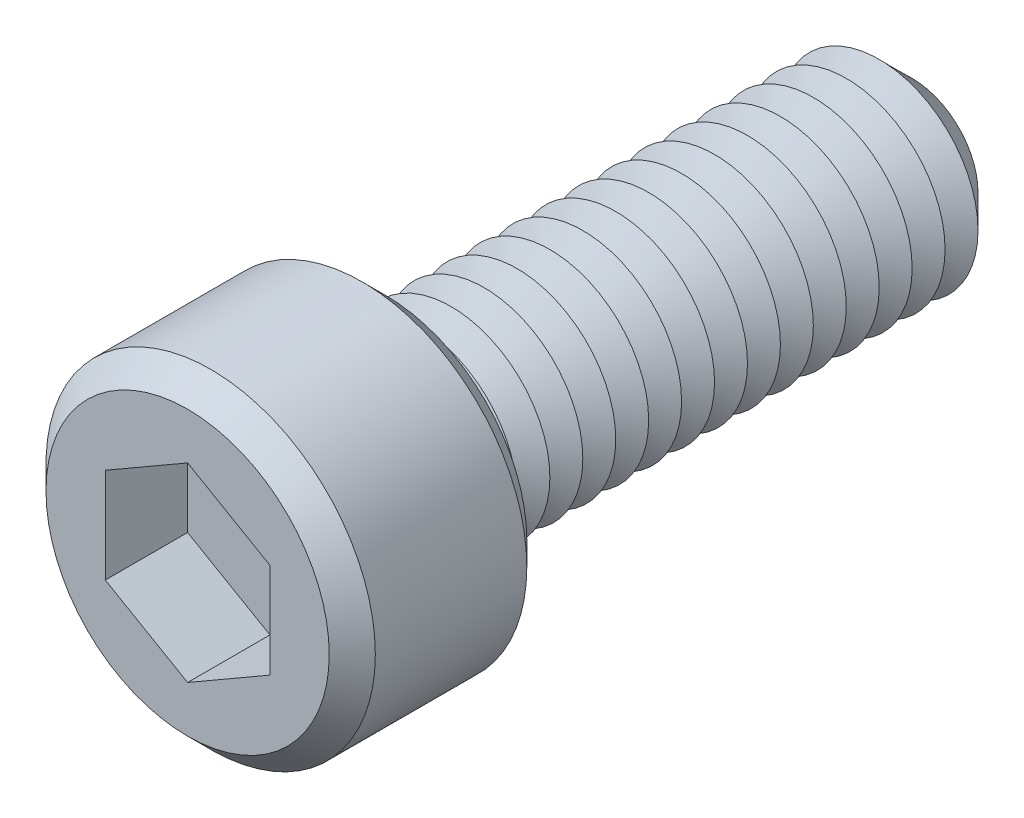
SolidWorks part; units mm, degrees
ref_plane "Front Plane" through (0, 0, 0) normal (0, 0, 1) x (1, 0, 0)
ref_plane "Top Plane" through (0, 0, 0) normal (0, 1, 0) x (1, 0, 0)
ref_plane "Right Plane" through (0, 0, 0) normal (1, 0, 0) x (0, 0, -1)
sketch "Sketch1" plane through (0, 0, 0) normal (0, 0, 1) x (1, 0, 0)
  circle A0 centre (0, 0) radius 5
  dimension "D1" = 10
extrude "Boss-Extrude1" add sketch "Sketch1" along normal blind 6
sketch "Sketch2" plane through (0, 0, 0) normal (0, 0, -1) x (-1, 0, 0)
  circle A0 centre (0, 0) radius 3
  dimension "D1" = 6
extrude "Boss-Extrude2" add sketch "Sketch2" along normal blind 16
chamfer "Chamfer1" distance 1 angle 45 1 edges at (-3, 0, -16)
sketch "Sketch3" plane through (0, 0, 0) normal (1, 0, 0) x (0, 0, -1)
  line L0 (-2.5121, 0) -> (4.5776, 0) construction
sketch "Sketch4" plane through (0, 0, 0) normal (1, 0, 0) x (0, 0, -1)
  line L0 (0, 3) -> (0.5, 2.134)
  line L1 (0.5, 2.134) -> (1, 3)
  line L2 (15, 3) -> (0, 3) construction
  line L3 (1, 3) -> (0, 3)
  dimension "D1" = 1
revolve "Cut-Revolve1" cut sketch "Sketch4" angle 360 about L0
pattern_linear "LPattern1" count 15 spacing 1 along (0, 0, -1) of "Cut-Revolve1"
sketch "Sketch5" plane through (0, 0, 6) normal (0, 0, 1) x (1, 0, 0)
  line L1 (0, 2.8868) -> (-2.5, 1.4434)
  line L2 (-2.5, 1.4434) -> (-2.5, -1.4434)
  line L3 (-2.5, -1.4434) -> (0, -2.8868)
  line L4 (0, -2.8868) -> (2.5, -1.4434)
  line L5 (2.5, -1.4434) -> (2.5, 1.4434)
  line L6 (2.5, 1.4434) -> (0, 2.8868)
  circle A0 centre (0, 0) radius 2.5 construction
  dimension "D1" = 5
extrude "Cut-Extrude1" cut sketch "Sketch5" against normal blind 2.5
sketch "Sketch6" plane through (0, 0, 3.5) normal (0, 0, 1) x (1, 0, 0)
  circle A0 centre (0, 0) radius 0.8
  dimension "D1" = 1.6
extrude "Cut-Extrude2" cut sketch "Sketch6" against normal up to surface (19.5 mm away)
chamfer "Chamfer2" distance 0.7 angle 45 2 edges at (5, 0, 0) (5, 0, 6)
